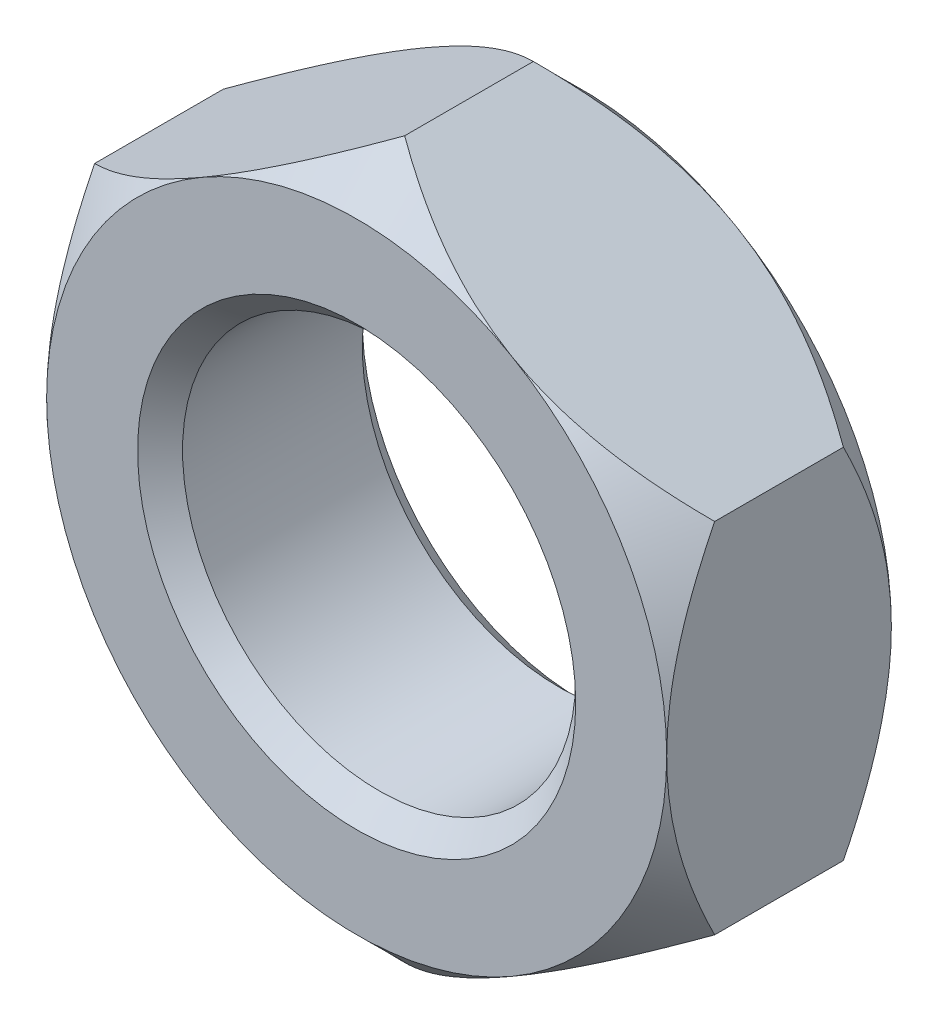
SolidWorks part; units mm, degrees
ref_plane "Front" through (0, 0, 0) normal (0, 0, 1) x (1, 0, 0)
ref_plane "Top" through (0, 0, 0) normal (0, 1, 0) x (1, 0, 0)
ref_plane "Right" through (0, 0, 0) normal (1, 0, 0) x (0, 0, -1)
sketch "Sketch1" plane through (0, 0, 0) normal (0, 0, 1) x (1, 0, 0)
  line L0 (0, 10.1186) -> (8.763, 5.0593)
  line L1 (8.763, 5.0593) -> (8.763, -5.0593)
  line L2 (8.763, -5.0593) -> (0, -10.1186)
  line L3 (0, -10.1186) -> (-8.763, -5.0593)
  line L4 (-8.763, -5.0593) -> (-8.763, 5.0593)
  line L5 (-8.763, 5.0593) -> (0, 10.1186)
  line L6 (0, 0) -> (0, 13.4118) construction
  line L7 (0, 0) -> (13.7534, 0) construction
  circle A0 centre (0, 0) radius 8.763 construction
extrude "Base-Extrude" add sketch "Sketch1" along normal mid plane 6.35
sketch "Sketch3" plane through (0, 0, 0) normal (1, 0, 0) x (0, 0, -1)
  line L0 (-5.0067, 0) -> (9.8019, 0) construction
  line L1 (50, 0) -> (-50, 0) construction
  line L2 (-1.8194, 10.1186) -> (-3.175, 10.1186)
  line L3 (-3.175, 10.1186) -> (-3.175, 8.763)
  line L4 (-3.175, 8.763) -> (-1.8194, 10.1186)
  line L5 (-3.175, 10.1186) -> (3.175, 10.1186) construction
  line L9 (-3.175, 5.0593) -> (-3.175, 10.1186) construction
revolve "Cut-Revolve1" cut sketch "Sketch3" angle 360 about L0
sketch "Sketch6" plane through (0, 0, 0) normal (1, 0, 0) x (0, 0, -1)
  line L0 (0, 0) -> (5.3139, 0) construction
  line L1 (-5.0067, 0) -> (9.8019, 0) construction
  line L2 (1.8194, 10.1186) -> (3.175, 10.1186)
  line L3 (-1.8194, 10.1186) -> (3.175, 10.1186) construction
  line L4 (3.175, 10.1186) -> (3.175, 8.763)
  line L5 (3.175, 5.0593) -> (3.175, 10.1186) construction
  line L6 (1.8194, 10.1186) -> (3.175, 8.763)
  line L9 (-3.175, 10.1186) -> (-3.175, 8.763) construction
revolve "Cut-Revolve3" cut sketch "Sketch6" angle 360 about L0
sketch "Sketch7" plane through (0, 0, -3.175) normal (0, 0, -1) x (-1, 0, 0)
  circle A0 centre (0, 0) radius 7.2143
  dimension "D1" = 14.4286
extrude "Boss-Extrude1" [suppressed] add sketch "Sketch7" along normal blind 0.8222
sketch "Sketch4" plane through (0, 0, 3.175) normal (0, 0, 1) x (1, 0, 0)
  circle A0 centre (0, 0) radius 5.5562
  dimension "D1" = 11.1125
extrude "Cut-Extrude1" cut sketch "Sketch4" against normal through all
chamfer "Chamfer1" distance 0.635 angle 45 1 edges at (5.5562, 0, 3.175)
chamfer "Chamfer3" [suppressed] distance 0.635 angle 45
chamfer "Chamfer2" distance 0.635 angle 45 1 edges at (5.5562, 0, -3.175)
